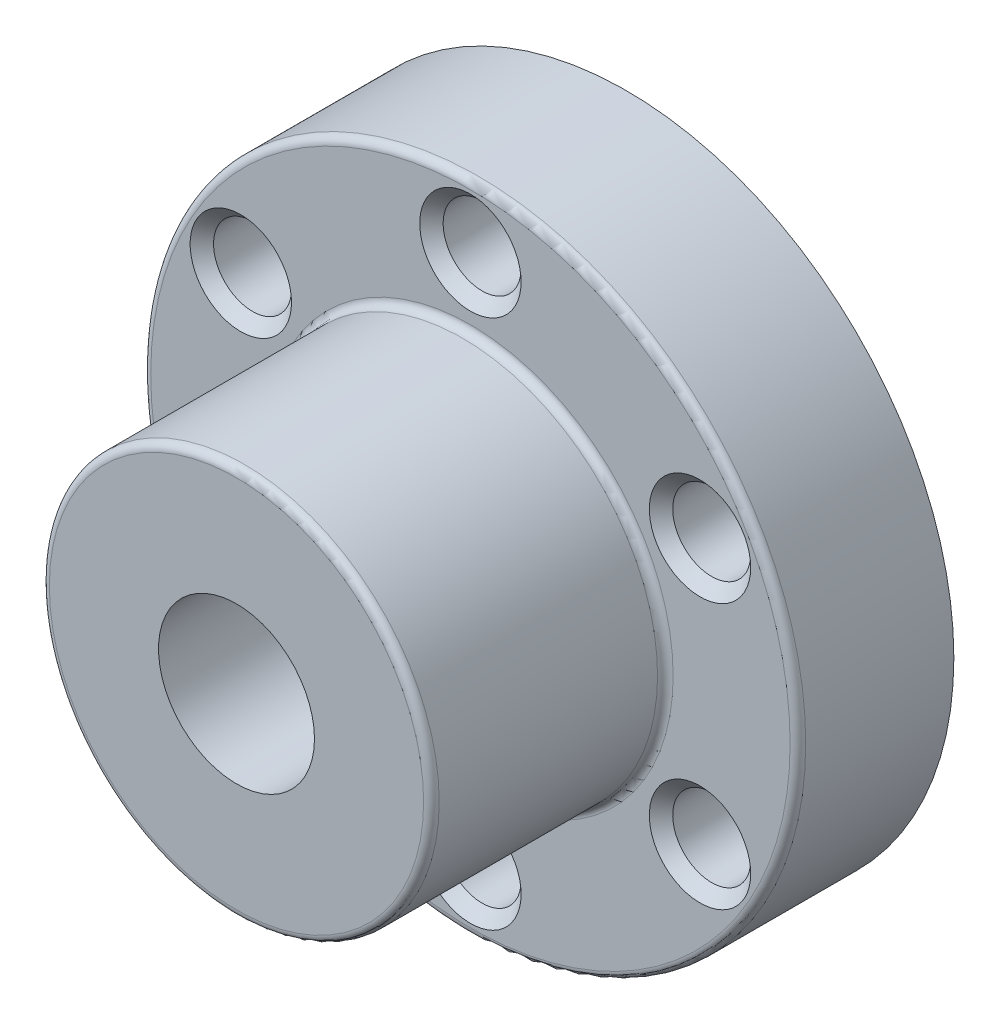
SolidWorks part; units mm, degrees
ref_plane "Front Plane" through (0, 0, 0) normal (0, 0, 1) x (1, 0, 0)
ref_plane "Top Plane" through (0, 0, 0) normal (0, 1, 0) x (1, 0, 0)
ref_plane "Right Plane" through (0, 0, 0) normal (1, 0, 0) x (0, 0, -1)
sketch "Sketch1" plane through (0, 0, 0) normal (0, 0, 1) x (1, 0, 0)
  circle A0 centre (0, 0) radius 21
  dimension "D1" = 42
extrude "Boss-Extrude1" add sketch "Sketch1" along normal blind 10
sketch "Sketch2" plane through (0, 0, 10) normal (0, 0, 1) x (1, 0, 0)
  circle A0 centre (0, 0) radius 12.5
  dimension "D1" = 25
extrude "Boss-Extrude2" add sketch "Sketch2" along normal blind 15
sketch "Sketch3" plane through (0, 0, 25) normal (0, 0, 1) x (1, 0, 0)
  circle A0 centre (0, 0) radius 5
  dimension "D1" = 10
extrude "Cut-Extrude1" cut sketch "Sketch3" against normal through all
sketch "Sketch4" plane through (0, 0, 0) normal (0, 0, -1) x (-1, 0, 0)
  circle A0 centre (0, 0) radius 17 construction
  circle A1 centre (0, 17) radius 2.5
  dimension "D1" = 34
  dimension "D2" = 5
extrude "Cut-Extrude2" cut sketch "Sketch4" against normal through all
fillet "Fillet1" radius 0.5 3 edges at (21, 0, 10) (12.5, 0, 10) (12.5, 0, 25)
chamfer "Chamfer2" distance 0.75 angle 45 1 edges at (2.5, 17, 10)
pattern_circular "CirPattern2" count 6 over 360 about axis through (0, 0, 0) along (0, 0, 1) of "Chamfer2", "Cut-Extrude2"
